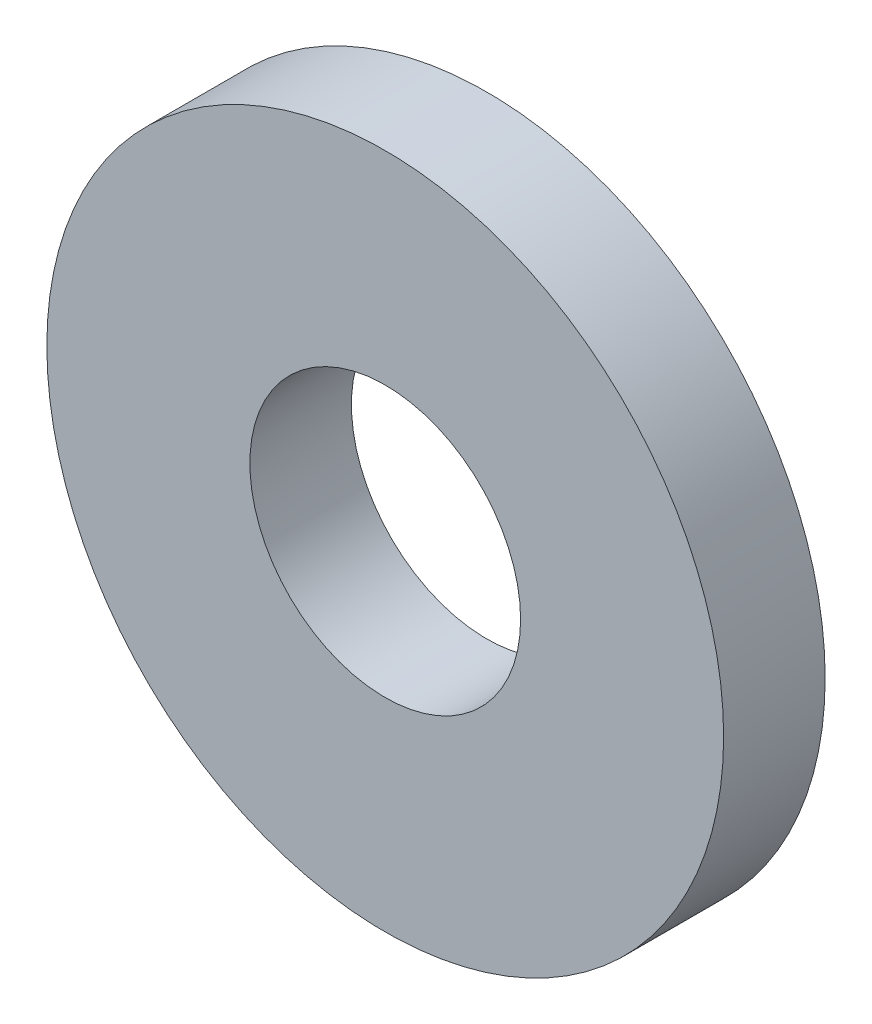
SolidWorks part; units mm, degrees
ref_plane "Plan de face" through (0, 0, 0) normal (0, 0, 1) x (1, 0, 0)
ref_plane "Plan de dessus" through (0, 0, 0) normal (0, 1, 0) x (1, 0, 0)
ref_plane "Plan de droite" through (0, 0, 0) normal (1, 0, 0) x (0, 0, -1)
sketch "Esquisse1" plane through (0, 0, 0) normal (0, 0, 1) x (1, 0, 0)
  circle A0 centre (0, 0) radius 10
  circle A1 centre (0, 0) radius 4
  dimension "D1" = 8
  dimension "D2" = 20
extrude "Boss.-Extru.1" add sketch "Esquisse1" along normal blind 3
